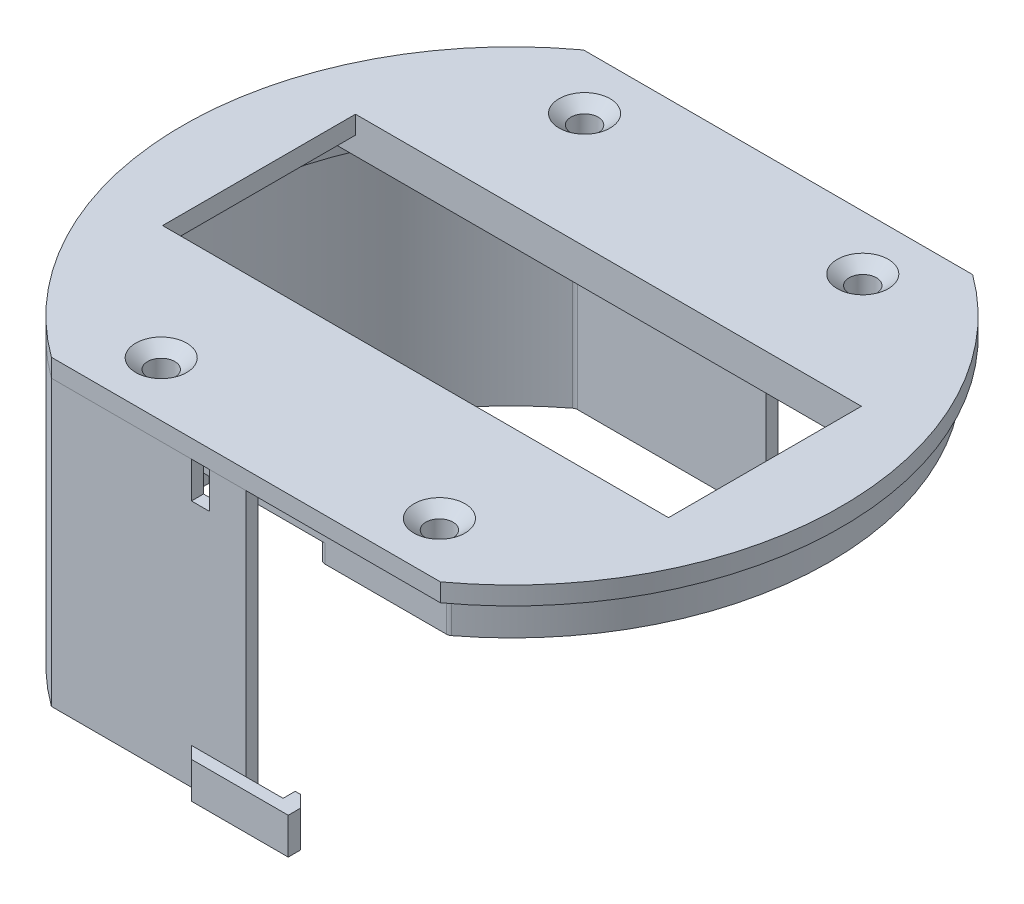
SolidWorks part; units mm, degrees
other "<a1_t42>-<<a_base_t42>-<#8 Clearance Hole1>>"
ref_plane "Front Plane" through (0, 0, 0) normal (0, 0, 1) x (1, 0, 0)
ref_plane "Top Plane" through (0, 0, 0) normal (0, 1, 0) x (1, 0, 0)
ref_plane "Right Plane" through (0, 0, 0) normal (1, 0, 0) x (0, 0, -1)
inserted part "a1_t42"
sketch "Sketch1" plane through (0, 0, 0) normal (0, -1, 0) x (1, 0, 0)
  line L2 (-32.1598, -44) -> (32.1598, -44)
  line L3 (32.1598, 44) -> (-32.1598, 44)
  line L4 (-32.1598, -44) -> (32.1598, -44)
  line L5 (32.1598, 44) -> (-32.1598, 44)
  line L6 (-31.1649, -42) -> (31.1649, -42)
  line L7 (31.1649, 42) -> (-31.1649, 42)
  line L8 (-31.1649, -42) -> (31.1649, -42)
  line L9 (31.1649, 42) -> (-31.1649, 42)
  arc A2 (-32.1598, 44) -> (-32.1598, -44) centre (0, 0) ccw
  arc A3 (32.1598, -44) -> (32.1598, 44) centre (0, 0) ccw
  arc A4 (-32.1598, 44) -> (-32.1598, -44) centre (0, 0) ccw
  arc A5 (32.1598, -44) -> (32.1598, 44) centre (0, 0) ccw
  arc A10 (31.77, -41.7961) -> (31.77, 41.7961) centre (0, 0) ccw
  arc A11 (31.1649, -42) -> (31.77, -41.7961) centre (31.1649, -41) ccw
  arc A12 (-31.77, -41.7961) -> (-31.1649, -42) centre (-31.1649, -41) ccw
  arc A13 (-31.77, 41.7961) -> (-31.77, -41.7961) centre (0, 0) ccw
  arc A14 (-31.1649, 42) -> (-31.77, 41.7961) centre (-31.1649, 41) ccw
  arc A15 (31.77, 41.7961) -> (31.1649, 42) centre (31.1649, 41) ccw
  arc A16 (31.77, -41.7961) -> (31.77, 41.7961) centre (0, 0) ccw
  arc A17 (31.1649, -42) -> (31.77, -41.7961) centre (31.1649, -41) ccw
  arc A18 (-31.77, -41.7961) -> (-31.1649, -42) centre (-31.1649, -41) ccw
  arc A19 (-31.77, 41.7961) -> (-31.77, -41.7961) centre (0, 0) ccw
  arc A20 (-31.1649, 42) -> (-31.77, 41.7961) centre (-31.1649, 41) ccw
  arc A21 (31.77, 41.7961) -> (31.1649, 42) centre (31.1649, 41) ccw
  dimension "D1" = 0
  dimension "D2" = 0
extrude "Shell Body" add sketch "Sketch1" along normal blind 47 separate body
sketch "Sketch2" plane through (0, -47, 0) normal (0, -1, 0) x (1, 0, 0)
  line L0 (32.1598, 44) -> (-32.1598, 44) construction
  line L1 (0, 44) -> (54.5, 44)
  line L2 (0, 44) -> (0, -44)
  line L3 (0, -44) -> (54.5, -44)
  line L4 (54.5, 44) -> (54.5, -44)
  line L5 (-32.1598, -44) -> (32.1598, -44) construction
  arc A0 (32.1598, -44) -> (32.1598, 44) centre (0, 0) ccw construction
extrude "Body Cut" cut sketch "Sketch2" against normal through all
sketch "Sketch3" plane through (0, 0, 44) normal (0, 0, 1) x (1, 0, 0)
  line L0 (0, 0) -> (-32.1598, 0) construction
  line L1 (-9, 0) -> (-6, 0)
  line L2 (-9, 0) -> (-9, -6)
  line L3 (-9, -6) -> (-6, -6)
  line L4 (-6, 0) -> (-6, -6)
  line L5 (0, 0) -> (-6, 0) construction
  dimension "D1" = 6
  dimension "D2" = 3
extrude "Clearance - Tabs" cut sketch "Sketch3" against normal through all
sketch "Sketch4" plane through (0, -47, 0) normal (0, -1, 0) x (1, 0, 0)
  line L0 (0, 0) -> (-52.5, 0) construction
  line L1 (-9, 44) -> (6.15, 44)
  line L2 (0, 44) -> (-32.1598, 44) construction
  line L3 (6.15, 44) -> (6.15, 42)
  line L4 (6.15, 42) -> (9, 42)
  line L5 (9, 42) -> (9, 46)
  line L6 (9, 46) -> (-9, 46)
  line L7 (-9, 46) -> (-9, 44)
  line L8 (0, 44) -> (0, 42) construction
  line L9 (0, 42) -> (-31.1649, 42) construction
  line L10 (6.15, -42) -> (9, -42)
  line L11 (6.15, -44) -> (6.15, -42)
  line L12 (-9, -44) -> (6.15, -44)
  line L13 (-9, -46) -> (-9, -44)
  line L14 (9, -46) -> (-9, -46)
  line L15 (9, -42) -> (9, -46)
  arc A0 (-31.77, 41.7961) -> (-31.77, -41.7961) centre (0, 0) ccw construction
  dimension "D1" = 2
  dimension "D2" = 9
  dimension "D3" = 9
  dimension "D4" = 6.15
extrude "Tabs" add sketch "Sketch4" against normal blind 6
chamfer "Tab Chamfer" distance 2 angle 45 4 edges at (9, -44, -42) (9, -44, 42) (-9, -44, -46) (-9, -44, 46)
ref_point "Point1"
equation "\"D1@Sketch3\"=\"width keep@values@params_print.SLDPRT\"*2"
equation "\"D2@Sketch3\"=\"width keep@values@params_print.SLDPRT\""
equation "\"D3@Sketch4\"=\"width keep@values@params_print.SLDPRT\"*3"
equation "\"D4@Sketch4\"=2*\"width keep@values@params_print.SLDPRT\"+\"print fit@values@params_print.SLDPRT\""
equation "\"D1@Tabs\"=2*\"width keep@values@params_print.SLDPRT\""
